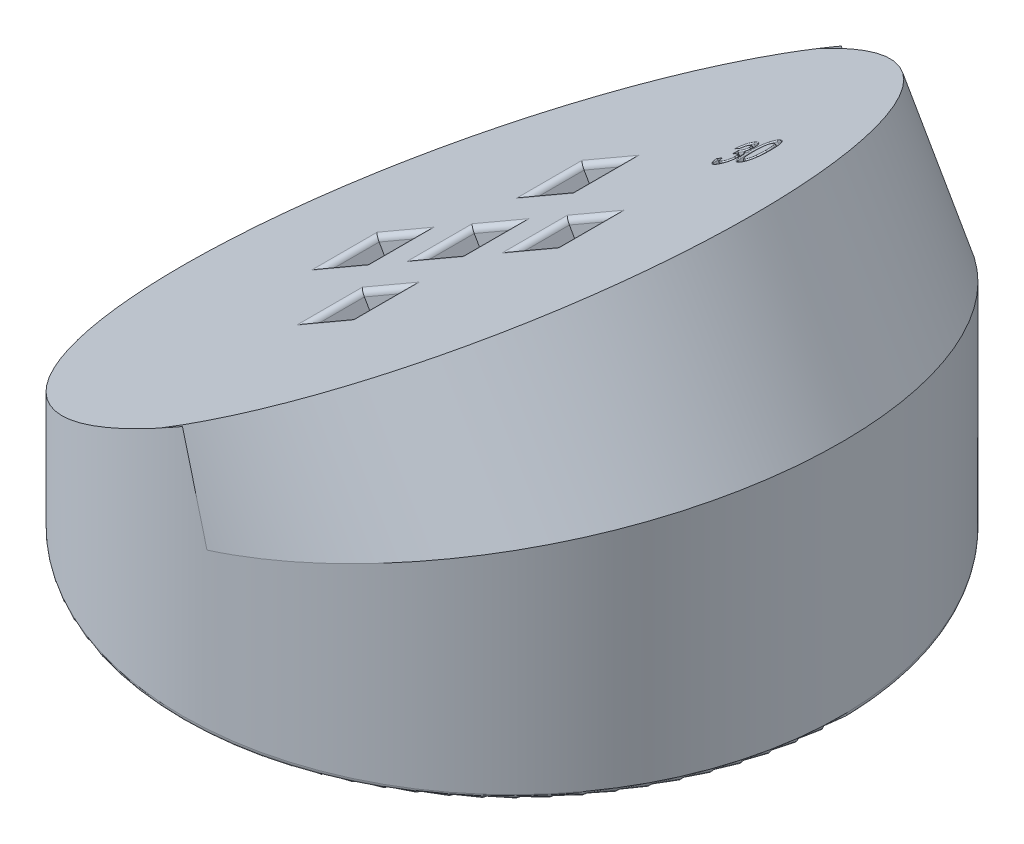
SolidWorks part; units mm, degrees
ref_plane "Front Plane" through (0, 0, 0) normal (0, 0, 1) x (1, 0, 0)
ref_plane "Top Plane" through (0, 0, 0) normal (0, 1, 0) x (1, 0, 0)
ref_plane "Right Plane" through (0, 0, 0) normal (1, 0, 0) x (0, 0, -1)
sketch "Sketch1" plane through (0, 0, 0) normal (0, 1, 0) x (1, 0, 0)
  circle A0 centre (0, 0) radius 30
extrude "Boss-Extrude1" add sketch "Sketch1" along normal blind 50
sketch "Sketch3" plane through (0, 50, 0) normal (0, 1, 0) x (1, 0, 0)
sketch "Sketch4" plane through (0, 0, 0) normal (0, -1, 0) x (-1, 0, 0)
  line L0 (0, 0) -> (-10, 0) construction
  line L1 (0, 0) -> (0, -10) construction
  line L2 (0, 0) -> (0, 10) construction
  line L3 (0, 0) -> (10, 0) construction
  line L5 (-2.5, 2.5) -> (2.5, 2.5)
  line L6 (-2.5, 2.5) -> (-2.5, -2.5)
  line L7 (-2.5, -2.5) -> (2.5, -2.5)
  line L8 (2.5, 2.5) -> (2.5, -2.5)
  line L9 (-2.5, 2.5) -> (2.5, -2.5) construction
  line L10 (-2.5, -2.5) -> (2.5, 2.5) construction
  line L11 (-2.5, -7.5) -> (2.5, -7.5)
  line L12 (-2.5, -7.5) -> (-2.5, -12.5)
  line L13 (-2.5, -12.5) -> (2.5, -12.5)
  line L14 (2.5, -7.5) -> (2.5, -12.5)
  line L15 (-2.5, -7.5) -> (2.5, -12.5) construction
  line L16 (-2.5, -12.5) -> (2.5, -7.5) construction
  line L17 (7.5, 2.5) -> (12.5, 2.5)
  line L18 (7.5, 2.5) -> (7.5, -2.5)
  line L19 (7.5, -2.5) -> (12.5, -2.5)
  line L20 (12.5, 2.5) -> (12.5, -2.5)
  line L21 (7.5, 2.5) -> (12.5, -2.5) construction
  line L22 (7.5, -2.5) -> (12.5, 2.5) construction
  line L23 (-12.5, 2.5) -> (-7.5, 2.5)
  line L24 (-12.5, 2.5) -> (-12.5, -2.5)
  line L25 (-12.5, -2.5) -> (-7.5, -2.5)
  line L26 (-7.5, 2.5) -> (-7.5, -2.5)
  line L27 (-12.5, 2.5) -> (-7.5, -2.5) construction
  line L28 (-12.5, -2.5) -> (-7.5, 2.5) construction
  line L29 (2.5, 7.5) -> (-2.5, 7.5)
  line L30 (2.5, 7.5) -> (2.5, 12.5)
  line L31 (2.5, 12.5) -> (-2.5, 12.5)
  line L32 (-2.5, 7.5) -> (-2.5, 12.5)
  line L33 (2.5, 7.5) -> (-2.5, 12.5) construction
  line L34 (2.5, 12.5) -> (-2.5, 7.5) construction
  dimension "D1" = 5
  dimension "D2" = 5
  dimension "D3" = 5
  dimension "D4" = 5
  dimension "D5" = 5
  dimension "D6" = 5
extrude "Cut-Extrude2" cut sketch "Sketch4" against normal blind 3
fillet "Fillet2" radius 0.5 21 edges at (0, 0, 30) (2.5, 0, 0) (0, 0, 2.5) (-2.5, 0, 0) (0, 0, -2.5) (2.5, 0, 10) (0, 0, 12.5) (-2.5, 0, 10) (0, 0, 7.5) (-7.5, 0, 0) (-10, 0, 2.5) (-12.5, 0, 0) (-10, 0, -2.5) (12.5, 0, 0) (10, 0, 2.5) (7.5, 0, 0) (10, 0, -2.5) (-2.5, 0, -10) (0, 0, -12.5) (2.5, 0, -10) (0, 0, -7.5)
ref_plane "Plane6" through (0, 0, 3.5) normal (0, 0, 1) x (1, 0, 0)
sketch "Sketch13" plane through (0, 0, 3.5) normal (0, 0, 1) x (1, 0, 0)
  line L0 (-30, 6) -> (30, 40.641)
  line L1 (-30, 50) -> (-30, 0.5) construction
  line L2 (30, 0.5) -> (30, 50) construction
  line L3 (30, 40.641) -> (30, 50)
  line L4 (30, 50) -> (-30, 50)
  line L5 (-30, 50) -> (-30, 6)
  line L6 (30, 0.5) -> (-30, 0.5) construction
  dimension "D1" = 5.5
  dimension "D2" = 30
extrude "Cut-Extrude10" cut sketch "Sketch13" against normal mid plane 90
ref_plane "Plane4" through (0, 0, -2.5) normal (0, 0, -1) x (-1, 0, 0)
ref_plane "Plane5" through (0, 0, -62.5) normal (0, 0, -1) x (-1, 0, 0)
sketch "Sketch15" plane through (-10.0981, 17.4904, 0) normal (-0.5, 0.866, 0) x (0.866, 0.5, 0)
  line L0 (-22.9808, 0) -> (0, 0) construction
  line L2 (-0.4808, -2.5) -> (-5.4808, -2.5)
  line L3 (-0.4808, -2.5) -> (-0.4808, 2.5)
  line L4 (-0.4808, 2.5) -> (-5.4808, 2.5)
  line L5 (-5.4808, -2.5) -> (-5.4808, 2.5)
  line L6 (-0.4808, -2.5) -> (-5.4808, 2.5) construction
  line L7 (-0.4808, 2.5) -> (-5.4808, -2.5) construction
  line L8 (9.5192, -2.5) -> (4.5192, -2.5)
  line L9 (9.5192, -2.5) -> (9.5192, 2.5)
  line L10 (9.5192, 2.5) -> (4.5192, 2.5)
  line L11 (4.5192, -2.5) -> (4.5192, 2.5)
  line L12 (9.5192, -2.5) -> (4.5192, 2.5) construction
  line L13 (9.5192, 2.5) -> (4.5192, -2.5) construction
  line L14 (19.5192, -2.5) -> (14.5192, -2.5)
  line L15 (19.5192, -2.5) -> (19.5192, 2.5)
  line L16 (19.5192, 2.5) -> (14.5192, 2.5)
  line L17 (14.5192, -2.5) -> (14.5192, 2.5)
  line L18 (19.5192, -2.5) -> (14.5192, 2.5) construction
  line L19 (19.5192, 2.5) -> (14.5192, -2.5) construction
  line L20 (9.5192, -12.5) -> (4.5192, -12.5)
  line L21 (9.5192, -12.5) -> (9.5192, -7.5)
  line L22 (9.5192, -7.5) -> (4.5192, -7.5)
  line L23 (4.5192, -12.5) -> (4.5192, -7.5)
  line L24 (9.5192, -12.5) -> (4.5192, -7.5) construction
  line L25 (9.5192, -7.5) -> (4.5192, -12.5) construction
  line L26 (9.5192, 7.5) -> (4.5192, 7.5)
  line L27 (9.5192, 7.5) -> (9.5192, 12.5)
  line L28 (9.5192, 12.5) -> (4.5192, 12.5)
  line L29 (4.5192, 7.5) -> (4.5192, 12.5)
  line L30 (9.5192, 7.5) -> (4.5192, 12.5) construction
  line L31 (9.5192, 12.5) -> (4.5192, 7.5) construction
  ellipse E0 centre (11.6603, 0) end of major axis (-22.9808, 0) minor radius 30 construction
  point P9 (-2.9808, 0)
  point P14 (7.0192, 0)
  point P19 (17.0192, 0)
  point P24 (7.0192, -10)
  point P29 (7.0192, 10)
  dimension "D1" = 40
  dimension "D2" = 30
  dimension "D3" = 20
  dimension "D4" = 5
  dimension "D5" = 5
  dimension "D6" = 5
  dimension "D7" = 5
  dimension "D8" = 5
  dimension "D9" = 5
  dimension "D10" = 5
  dimension "D11" = 5
  dimension "D12" = 10
  dimension "D13" = 10
  dimension "D14" = 5
  dimension "D15" = 5
extrude "Cut-Extrude11" cut sketch "Sketch15" against normal blind 3
ref_plane "Plane7" through (0, 0, 0) normal (0, 0, -1) x (-1, 0, 0)
sketch "Sketch24" plane through (-10.0981, 17.4904, 0) normal (-0.5, 0.866, 0) x (0.866, 0.5, 0)
  line L0 (7.0192, -30) -> (43.5601, -46.7605)
  line L1 (7.0192, 0) -> (-22.9808, 0)
  line L3 (43.5601, -46.7605) -> (61.6872, 6.9328)
  line L4 (61.6872, 6.9328) -> (28.4166, 53.986)
  line L5 (28.4166, 53.986) -> (7.0192, 34.4662)
  line L6 (7.0192, 34.4662) -> (7.0192, 30)
  arc A0 (7.0192, -30) -> (-22.9808, 0) centre (7.0192, 0) ccw
  ellipse E1 centre (11.6603, 0) end of major axis (-22.9808, 0) minor radius 30 construction
  dimension "D1" = 30
extrude "Cut-Extrude13" cut sketch "Sketch24" against normal blind 100 contours A0 M21
fillet "Fillet8" radius 0.5 4 edges at (-4.0192, 21, -7.5) (-1.8542, 22.25, -10) (-4.0192, 21, -12.5) (-6.1843, 19.75, -10)
fillet "Fillet9" radius 0.5 4 edges at (4.641, 26, 2.5) (6.8061, 27.25, 0) (4.641, 26, -2.5) (2.476, 24.75, 0)
fillet "Fillet10" radius 0.5 4 edges at (-14.8446, 14.75, 0) (-12.6795, 16, 2.5) (-10.5144, 17.25, 0) (-12.6795, 16, -2.5)
fillet "Fillet11" radius 0.5 4 edges at (-6.1843, 19.75, 10) (-4.0192, 21, 12.5) (-1.8542, 22.25, 10) (-4.0192, 21, 7.5)
fillet "Fillet12" radius 0.5 4 edges at (-6.1843, 19.75, 0) (-4.0192, 21, 2.5) (-1.8542, 22.25, 0) (-4.0192, 21, -2.5)
sketch "Sketch25" plane through (-10.0981, 17.4904, 0) normal (-0.5, 0.866, 0) x (0.866, 0.5, 0)
  text T0 "<b>30</b>"
extrude "Cut-Extrude14" cut sketch "Sketch25" against normal blind 4
fillet "Fillet13" radius 0.1 23 edges
